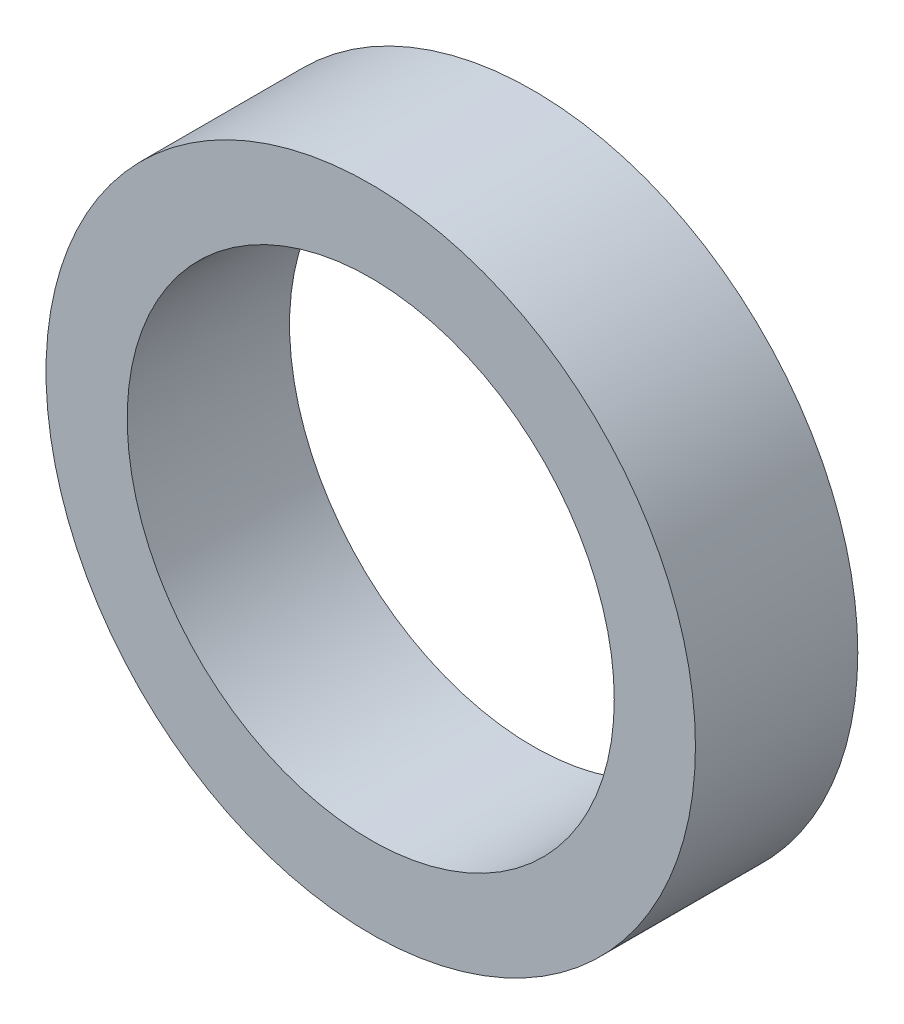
SolidWorks part; units mm, degrees
ref_plane "前视基准面" through (0, 0, 0) normal (0, 0, 1) x (1, 0, 0)
ref_plane "上视基准面" through (0, 0, 0) normal (0, 1, 0) x (1, 0, 0)
ref_plane "右视基准面" through (0, 0, 0) normal (1, 0, 0) x (0, 0, -1)
sketch "草图1" plane through (0, 0, 0) normal (0, 0, 1) x (1, 0, 0)
  circle A0 centre (0, 0) radius 9
  circle A1 centre (0, 0) radius 12
  dimension "D1" = 18
  dimension "D2" = 24
extrude "凸台-拉伸1" add sketch "草图1" along normal blind 6
